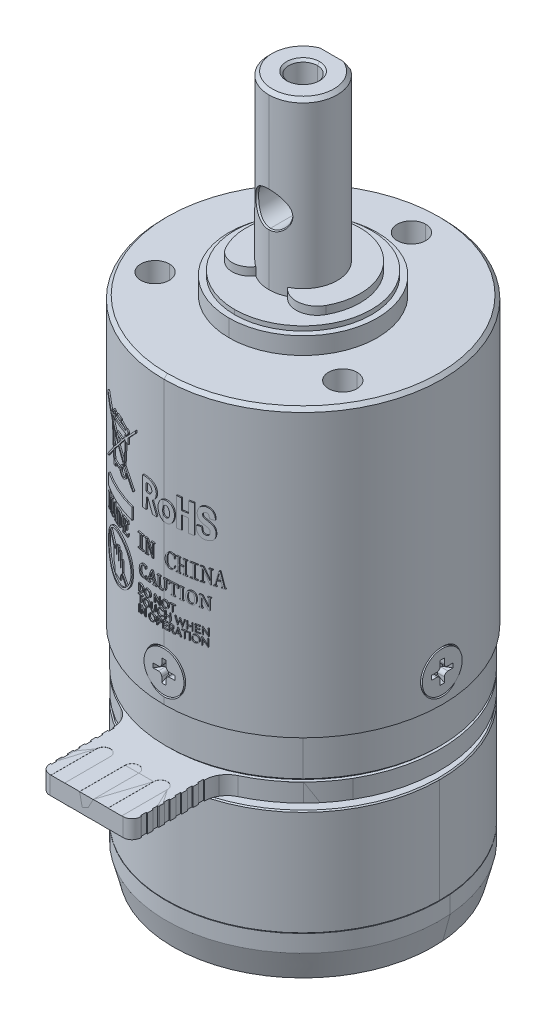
SolidWorks part; units mm, degrees
ref_plane "前视基准面" through (0, 0, 0) normal (0, 0, 1) x (1, 0, 0)
ref_plane "上视基准面" through (0, 0, 0) normal (0, 1, 0) x (1, 0, 0)
ref_plane "右视基准面" through (0, 0, 0) normal (1, 0, 0) x (0, 0, -1)
imported_body "输入1"
imported_body "输入2"
imported_body "输入3"
imported_body "输入4"
imported_body "输入5"
imported_body "输入6"
imported_body "输入7"
imported_body "输入8"
imported_body "输入9"
imported_body "输入10"
imported_body "输入11"
imported_body "输入12"
imported_body "输入13"
imported_body "输入14"
imported_body "输入15"
imported_body "输入16"
imported_body "输入17"
imported_body "输入18"
imported_body "曲面-输入1"
imported_body "曲面-输入2"
imported_body "曲面-输入3"
imported_body "曲面-输入4"
imported_body "曲面-输入5"
imported_body "曲面-输入6"
imported_body "曲面-输入7"
imported_body "曲面-输入8"
imported_body "曲面-输入9"
imported_body "曲面-输入10"
imported_body "曲面-输入11"
imported_body "曲面-输入12"
imported_body "曲面-输入13"
imported_body "曲面-输入14"
imported_body "曲面-输入15"
imported_body "曲面-输入16"
move or copy body "实体-移动/复制1" bodies to move or copy 120 111 110 121 106 118 107 117 108 122 119 116 123 placed by mates yes parameters "D1"=0, "D2"=0, "D3"=0
